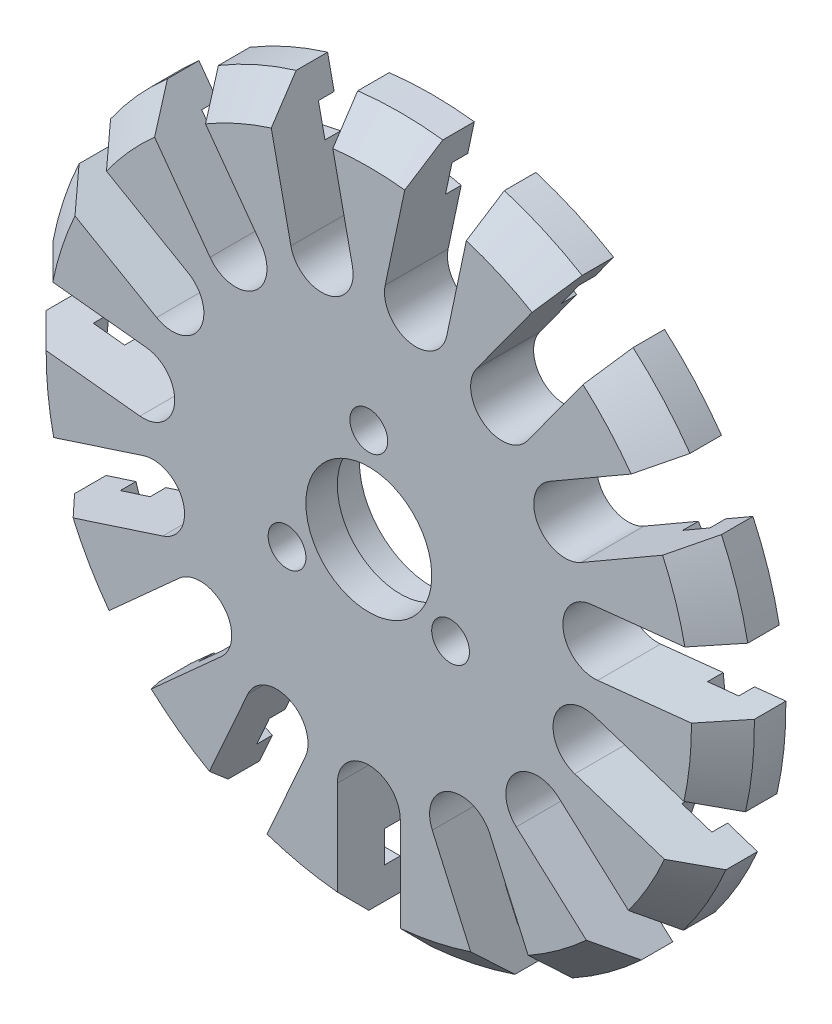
SolidWorks part; units mm, degrees
ref_plane "Plano frontal" through (0, 0, 0) normal (0, 0, 1) x (1, 0, 0)
ref_plane "Plano superior" through (0, 0, 0) normal (0, 1, 0) x (1, 0, 0)
ref_plane "Plano direito" through (0, 0, 0) normal (1, 0, 0) x (0, 0, -1)
sketch "Esboço1" plane through (0, 0, 0) normal (0, 0, 1) x (1, 0, 0)
  circle A0 centre (0, 0) radius 22.5
  dimension "D1" = 45
extrude "Ressalto-extrusão1" add sketch "Esboço1" along normal blind 4
chamfer "Chanfro1" distance 2 angle 45 1 edges at (22.5, 0, 4)
sketch "Esboço4" plane through (0, 0, 0) normal (0, 0, -1) x (-1, 0, 0)
  circle A0 centre (0, 0) radius 4.6
  dimension "D1" = 9.2
extrude "Corte-extrusão2" cut sketch "Esboço4" against normal blind 2 contours A0
sketch "Esboço5" plane through (0, 0, 2) normal (0, 0, -1) x (-1, 0, 0)
  circle A0 centre (0, 0) radius 4
  dimension "D1" = 8
extrude "Corte-extrusão3" cut sketch "Esboço5" against normal blind 2
sketch "Esboço6" plane through (0, 0, 0) normal (0, 0, -1) x (-1, 0, 0)
  line L0 (0, 0) -> (0, -22.5) construction
  line L1 (2, -22.4109) -> (2, -14.4109)
  line L2 (-2, -14.4109) -> (-2, -22.4109)
  circle A0 centre (0, 0) radius 22.5 construction
  arc A1 (-2, -22.4109) -> (2, -22.4109) centre (0, 0) ccw
  arc A2 (2, -14.4109) -> (-2, -14.4109) centre (0, -14.4109) ccw
  dimension "D1" = 4
  dimension "D2" = 8
extrude "Corte-extrusão4" cut sketch "Esboço6" against normal blind 4
pattern_circular "PadrãoCircular1" count 15 over 360 about axis through (0, 0, 0) along (0, 0, 1) of "Corte-extrusão4"
sketch "Esboço8" plane through (0, 0, 0) normal (0, 0, -1) x (-1, 0, 0)
  circle A0 centre (0, 0) radius 20.5
  circle A1 centre (0, 0) radius 18.5
  dimension "D1" = 41
  dimension "D2" = 37
sketch "Esboço9" plane through (0, 0, 4) normal (0, 0, 1) x (1, 0, 0)
  circle A0 centre (0, 0) radius 6
  circle A1 centre (0, 0) radius 4
  point P4 (0, 6)
  dimension "D1" = 8
  dimension "D2" = 12
hole_wizard "Furo com folga de M21" positions "3DSketch1" profile "Esboço10" hole size "M2" standard "ISO"
sketch3d "3DSketch1"
  point P0 (0, 6, 4)
sketch "Esboço10" plane through (0, 6, 4) normal (1, 0, 0) x (0, -1, 0)
  line L0 (0, 0) -> (0, 4)
  line L1 (0, 4) -> (1.2, 4)
  line L2 (1.2, 4) -> (1.2, 0)
  line L5 (1.2, 0) -> (0, 0)
  line L11 (0, -6.35) -> (0, 107.95) construction
  dimension "Thru Hole Dia." = 2.4
  dimension "Thru Hole Depth" = 4
pattern_circular "PadrãoCircular2" count 3 over 360 about axis through (0, 0, 0) along (0, 0, 1) of "Furo com folga de M21"
sketch "Esboço12" plane through (0, 0, 0) normal (0, 0, -1) x (-1, 0, 0)
  line L2 (3.5, -20.4109) -> (-3.5, -20.4109)
  line L3 (-3.5, -20.4109) -> (-3.5, -18.4109)
  line L4 (-3.5, -18.4109) -> (3.5, -18.4109)
  line L5 (3.5, -18.4109) -> (3.5, -20.4109)
  line L6 (0, 0) -> (0, -22.5) construction
  arc A0 (-7.2883, -21.2869) -> (-2, -22.4109) centre (0, 0) ccw construction
  point P0 (0, -18.4109)
  point P3 (0, 0)
  point P12 (0, 0)
  dimension "D1" = 2
  dimension "D2" = 7
  dimension "D3" = 2
extrude "Corte-extrusão5" cut sketch "Esboço12" against normal blind 1
pattern_circular "PadrãoCircular3" count 15 over 360 about axis through (0, 0, 0) along (0, 0, 1) of "Corte-extrusão5"
